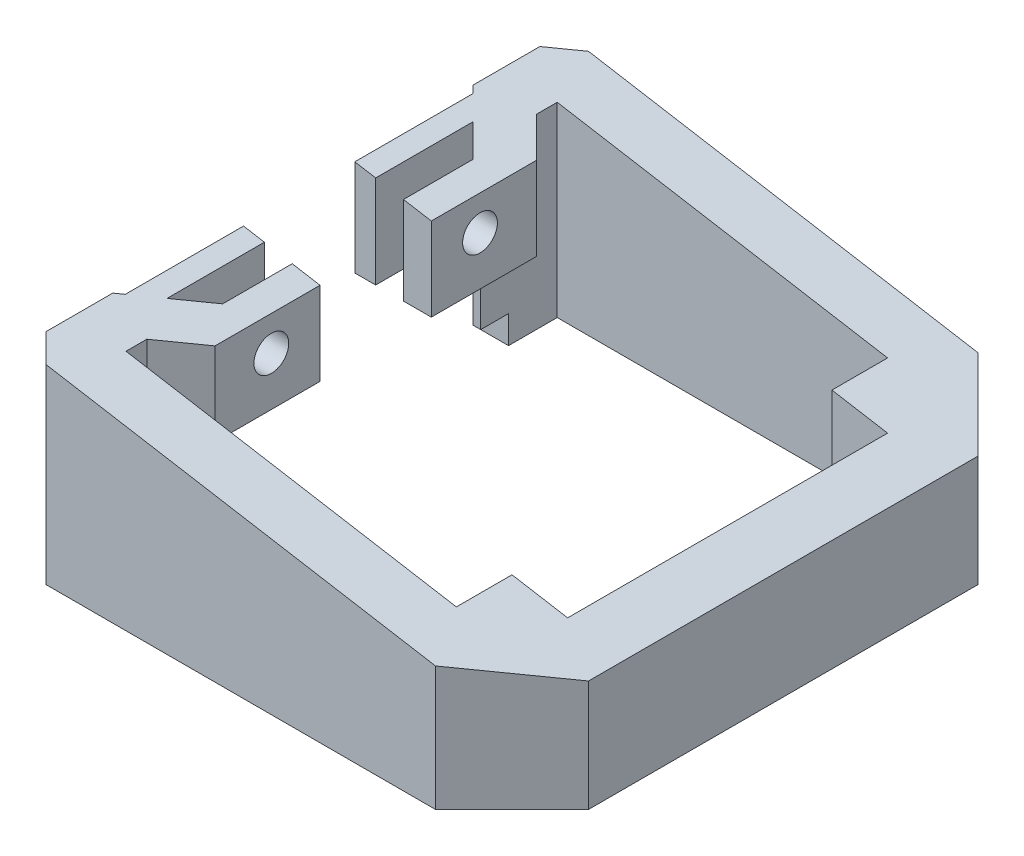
SolidWorks part; units mm, degrees
ref_plane "Front Plane" through (0, 0, 0) normal (0, 0, 1) x (1, 0, 0)
ref_plane "Top Plane" through (0, 0, 0) normal (0, 1, 0) x (1, 0, 0)
ref_plane "Right Plane" through (0, 0, 0) normal (1, 0, 0) x (0, 0, -1)
sketch "Sketch1" plane through (0, 0, 0) normal (0, 1, 0) x (1, 0, 0)
  line L0 (25.5, 1.5) -> (25.5, -2.5)
  line L1 (25.5, -2.5) -> (29.5, -2.5)
  line L2 (29.5, -2.5) -> (29.5, -25.5)
  line L3 (29.5, -25.5) -> (25.5, -25.5)
  line L4 (25.5, -25.5) -> (25.5, -29.5)
  line L5 (25.5, -29.5) -> (1.75, -29.5)
  line L6 (1.75, -29.5) -> (1.75, 1.5) construction
  line L7 (1.75, 1.5) -> (25.5, 1.5)
  line L8 (33.5, 0) -> (33.5, -28)
  line L9 (29.5, -14) -> (33.5, -14) construction
  line L10 (0, 5.5) -> (28, 5.5)
  line L11 (28, 5.5) -> (33.5, 0)
  line L12 (33.5, -28) -> (28, -33.5)
  line L13 (28, -33.5) -> (0, -33.5)
  line L14 (-3.25, -14) -> (1.75, -14) construction
  line L15 (0, -33.5) -> (-3.25, -30.25) construction
  line L16 (0, 5.5) -> (-3.25, 2.25) construction
  line L17 (-3.25, 2.25) -> (-3.25, -30.25) construction
  line L19 (-3.25, 2.25) -> (-3.25, -2.5) construction
  line L20 (-3.25, -2.5) -> (2.2, -7.95) construction
  line L21 (-3.25, -30.25) -> (-3.25, -25.5) construction
  line L22 (-3.25, -25.5) -> (2.2, -20.05) construction
  line L23 (2.2, -20.05) -> (2.2, -7.95)
  line L24 (1.75, 1.5) -> (1.75, 0)
  line L25 (1.75, -29.5) -> (1.75, -28)
  line L27 (1.75, 0) -> (4.2, -2.45)
  line L28 (1.75, -28) -> (4.2, -25.55)
  line L29 (4.2, -2.45) -> (4.2, -25.55)
  line L30 (0.2, -5.95) -> (0.2, -22.05)
  line L31 (-1.3, -4.45) -> (-1.3, -23.55)
  line L32 (-3.25, -2.5) -> (-1.3, -4.45) construction
  line L33 (0.2, -5.95) -> (2.2, -7.95)
  line L34 (0.2, -22.05) -> (2.2, -20.05)
  line L35 (-1.3, -23.55) -> (-3.25, -25.5) construction
  line L36 (-1.75, -24) -> (-1.75, -31.75)
  line L37 (-1.75, -24) -> (-1.3, -23.55)
  line L38 (0, -33.5) -> (-1.75, -31.75)
  line L39 (-1.75, 3.75) -> (-1.75, -4)
  line L40 (-1.75, 3.75) -> (0, 5.5)
  line L41 (-1.75, -4) -> (-1.3, -4.45)
  circle A0 centre (0, 0) radius 1.1
  circle A1 centre (28, 0) radius 1.1
  circle A2 centre (0, -28) radius 1.1
  circle A3 centre (28, -28) radius 1.1
  dimension "D1" = 2.2
  dimension "D2" = 28
  dimension "D3" = 28
  dimension "D4" = 2.5
  dimension "D6" = 2.5
  dimension "D9" = 1.75
  dimension "D14" = 5
  dimension "D5" = 2.5
  dimension "D7" = 4
  dimension "D8" = 4
  dimension "D10" = 4
  dimension "D11" = 4
  dimension "D12" = 4
  dimension "D13" = 225
  dimension "D15" = 2
  dimension "D16" = 4.2
  dimension "D18" = 2
  dimension "D19" = 1.5
  dimension "D20" = 1.75
extrude "Boss-Extrude1" add sketch "Sketch1" along normal blind 7
sketch "Sketch2" plane through (0, 7, 0) normal (0, 1, 0) x (1, 0, 0)
  line L0 (2.2, -14) -> (29.5, -14) construction
  line L1 (2.2, -7.95) -> (2.2, -20.05) construction
  line L2 (29.5, -25.5) -> (29.5, -2.5) construction
  line L3 (2.2, -5) -> (2.2, -23)
  line L4 (1.75, -28) -> (1.75, -29.5)
  line L5 (4.2, -25.55) -> (4.2, -2.45)
  line L6 (4.2, -2.45) -> (1.75, 0)
  line L7 (4.2, -2.45) -> (4.2, -25.55) construction
  line L8 (1.75, -29.5) -> (25.5, -29.5)
  line L9 (25.5, -29.5) -> (25.5, -25.5)
  line L10 (25.5, -25.5) -> (29.5, -25.5)
  line L11 (1.75, 0) -> (4.2, -2.45) construction
  line L12 (29.5, -25.5) -> (29.5, -2.5)
  line L14 (29.5, -2.5) -> (25.5, -2.5)
  line L15 (0, 5.5) -> (-1.75, 3.75)
  line L16 (-1.75, 3.75) -> (-1.75, -1.05)
  line L17 (-1.75, -1.05) -> (2.2, -5) construction
  line L18 (4.2, -25.55) -> (1.75, -28)
  line L19 (25.5, -2.5) -> (25.5, 1.5)
  line L21 (25.5, 1.5) -> (1.75, 1.5)
  line L22 (0, -33.5) -> (-1.75, -31.75)
  line L23 (-1.75, -31.75) -> (-1.75, -26.95)
  line L24 (-1.75, -26.95) -> (2.2, -23) construction
  line L25 (-1.3, -1.5) -> (-1.3, -26.5)
  line L26 (0.2, -3) -> (0.2, -25)
  line L27 (-1.75, -1.05) -> (-1.3, -1.5)
  line L28 (0.2, -3) -> (2.2, -5)
  line L29 (0.2, -25) -> (2.2, -23)
  line L30 (-1.3, -26.5) -> (-1.75, -26.95)
  line L31 (1.75, 1.5) -> (1.75, 0)
  line L32 (0, 5.5) -> (28, 5.5)
  line L33 (28, 5.5) -> (33.5, 0)
  line L34 (33.5, 0) -> (33.5, -28)
  line L35 (33.5, -28) -> (28, -33.5)
  line L36 (28, -33.5) -> (0, -33.5)
  line L37 (0.2, -5.95) -> (0.2, -22.05) construction
  point P8 (2.2, -14)
  dimension "D1" = 18
  dimension "D2" = 1.5
extrude "Boss-Extrude2" add sketch "Sketch2" along normal blind 7
sketch "Sketch4" plane through (4.2, 0, 0) normal (1, 0, 0) x (0, 0, -1)
  line L0 (-21.5, 10.5) -> (-6.5, 10.5) construction
  line L1 (-14, 14) -> (-14, 7) construction
  line L2 (-25.55, 14) -> (-2.45, 14) construction
  line L3 (-21.5, 10.5) -> (-23.7557, 10.5) construction
  line L4 (-6.5, 10.5) -> (-4.2443, 10.5) construction
  line L5 (-28, 7) -> (0, 7) construction
  circle A0 centre (-21.5, 10.5) radius 1.25
  circle A1 centre (-6.5, 10.5) radius 1.25
  point P12 (-14, 10.5)
  dimension "D1" = 2.5
  dimension "D2" = 15
extrude "Cut-Extrude1" cut sketch "Sketch4" against normal blind 2
sketch "Sketch7" plane through (2.2, 0, 0) normal (-1, 0, 0) x (0, 0, 1)
  line L0 (10, 14) -> (18, 14)
  line L3 (5, 14) -> (23, 14) construction
  line L4 (18, 14) -> (18, 0)
  line L5 (10, 14) -> (10, 0)
  line L6 (0, 4) -> (28, 4) construction
  line L7 (7.95, 0) -> (20.05, 0) construction
  line L8 (14, 4) -> (14, 0) construction
  line L9 (12, 4) -> (12, 0) construction
  line L10 (16, 4) -> (16, 0) construction
  line L11 (12, 2) -> (16, 2) construction
  line L12 (28, 14) -> (28, 0) construction
  line L15 (10, 0) -> (18, 0)
  point P21 (14, 2)
  dimension "D2" = 4
  dimension "D3" = 4
  dimension "D4" = 8
extrude "Cut-Extrude3" cut sketch "Sketch7" against normal up to next and the other way blind 6
sketch "Sketch8" plane through (0.2, 0, 0) normal (1, 0, 0) x (0, 0, -1)
  circle A0 centre (-21.5, 10.5) radius 0.75
  circle A1 centre (-6.5, 10.5) radius 0.75
  dimension "D1" = 1.5
extrude "Cut-Extrude4" cut sketch "Sketch8" against normal blind 2
sketch "Sketch9" plane through (0, 0, 33.5) normal (0, 0, 1) x (1, 0, 0)
  line L0 (-1.75, 4) -> (33.5, 4) construction
  line L1 (33.5, 14) -> (33.5, 0) construction
  line L2 (-1.75, 14) -> (33.5, 8)
  line L3 (33.5, 8) -> (33.5, 14)
  line L4 (33.5, 14) -> (-1.75, 14)
  line L5 (-1.75, 14) -> (-1.75, 0) construction
  dimension "D1" = 6
extrude "Cut-Extrude5" cut sketch "Sketch9" against normal through all
sketch "Sketch10" plane through (0, 0, 0) normal (0, -1, 0) x (1, 0, 0)
  line L0 (-1.75, 24) -> (1.75, 24) construction
  line L1 (-1.75, 26.95) -> (-1.75, 24)
  line L2 (1.75, 24) -> (1.75, 28)
  line L3 (1.75, 28) -> (4.2, 25.55)
  line L4 (4.2, 25.55) -> (4.2, 2.45)
  line L5 (-1.75, 26.95) -> (1.2, 24)
  line L6 (4.2, 2.45) -> (1.75, 0)
  line L7 (1.75, 0) -> (1.75, 4)
  line L8 (1.75, 4) -> (-1.75, 4) construction
  line L9 (-1.75, 26.95) -> (-1.3, 26.5) construction
  line L10 (-1.75, 4) -> (-1.3, 4.45)
  line L11 (-1.3, 4.45) -> (-1.3, 23.55)
  line L12 (-1.3, 23.55) -> (-1.75, 24)
  line L13 (1.2, 24) -> (1.75, 24)
  line L14 (-1.75, 4) -> (-1.75, 1.05)
  line L15 (-1.75, 1.05) -> (1.2, 4)
  line L16 (1.2, 4) -> (1.75, 4)
extrude "Cut-Extrude6" cut sketch "Sketch10" against normal up to surface (7 mm away)
sketch "Sketch11" plane through (0, 0, 0) normal (0, -1, 0) x (-1, 0, 0)
  line L0 (-1.75, 1.5) -> (-1.75, -4) construction
  line L1 (-1.75, -2) -> (1.7336, -2)
  line L2 (-1.75, -2) -> (-1.75, -26)
  line L3 (-1.75, -26) -> (1.7336, -26)
  line L4 (1.7336, -2) -> (1.7336, -26)
  line L5 (-1.2, -4) -> (-1.75, -4) construction
  line L6 (-1.75, -24) -> (-1.2, -24) construction
  point P8 (-1.475, -24)
  dimension "D1" = 2
  dimension "D2" = 2
extrude "Cut-Extrude7" cut sketch "Sketch11" against normal blind 2
